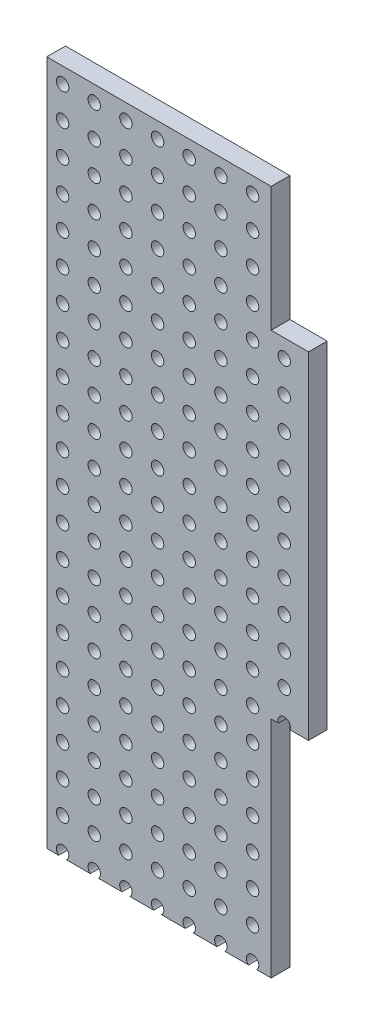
SolidWorks part; units mm, degrees
ref_plane "Plan1" through (0, 0, 0) normal (0, 0, 1) x (1, 0, 0)
ref_plane "Plan2" through (0, 0, 0) normal (0, 1, 0) x (1, 0, 0)
ref_plane "Plan3" through (0, 0, 0) normal (1, 0, 0) x (0, 0, -1)
sketch "Esquisse1" plane through (0, 0, 0) normal (0, 0, 1) x (1, 0, 0)
  line L1 (-71, 50) -> (-50, 50)
  line L2 (-71, 50) -> (-71, -5)
  line L3 (-71, -5) -> (-50, -5)
  line L4 (-50, 50) -> (-50, -5)
  dimension "D1" = 21
  dimension "D2" = 55
extrude "Base-Extrusion" add sketch "Esquisse1" along normal blind 1.5
sketch "Esquisse3" plane through (0, 0, 1.5) normal (0, 0, 1) x (1, 0, 0)
  line L2 (-50, -5) -> (-53, -5)
  line L3 (-50, -5) -> (-50, 13)
  line L4 (-50, 13) -> (-53, 13)
  line L5 (-53, -5) -> (-53, 13)
  dimension "D1" = 3
  dimension "D2" = 18
extrude "Enlèv. mat.-Extru.3" cut sketch "Esquisse3" against normal through all
sketch "Esquisse4" plane through (0, 0, 1.5) normal (0, 0, 1) x (1, 0, 0)
  line L1 (-50, 50) -> (-53, 50)
  line L2 (-50, 50) -> (-50, 40)
  line L3 (-50, 40) -> (-53, 40)
  line L4 (-53, 50) -> (-53, 40)
  dimension "D1" = 3
  dimension "D2" = 10
extrude "Enlèv. mat.-Extru.4" cut sketch "Esquisse4" against normal through all
sketch "Esquisse5" plane through (0, 0, 0) normal (0, 0, -1) x (-1, 0, 0)
  line L0 (71, 50) -> (71, -5) construction
  line L1 (53, 50) -> (71, 50) construction
  circle A0 centre (69.73, 48.73) radius 0.5
  dimension "D1" = 1.27
  dimension "D3" = 1
  dimension "D2" = 1.27
extrude "Enlèv. mat.-Extru.5" cut sketch "Esquisse5" against normal through all
pattern_linear "Répétition linéaire2" count 25 spacing 2.54 count 10 spacing 2.54
